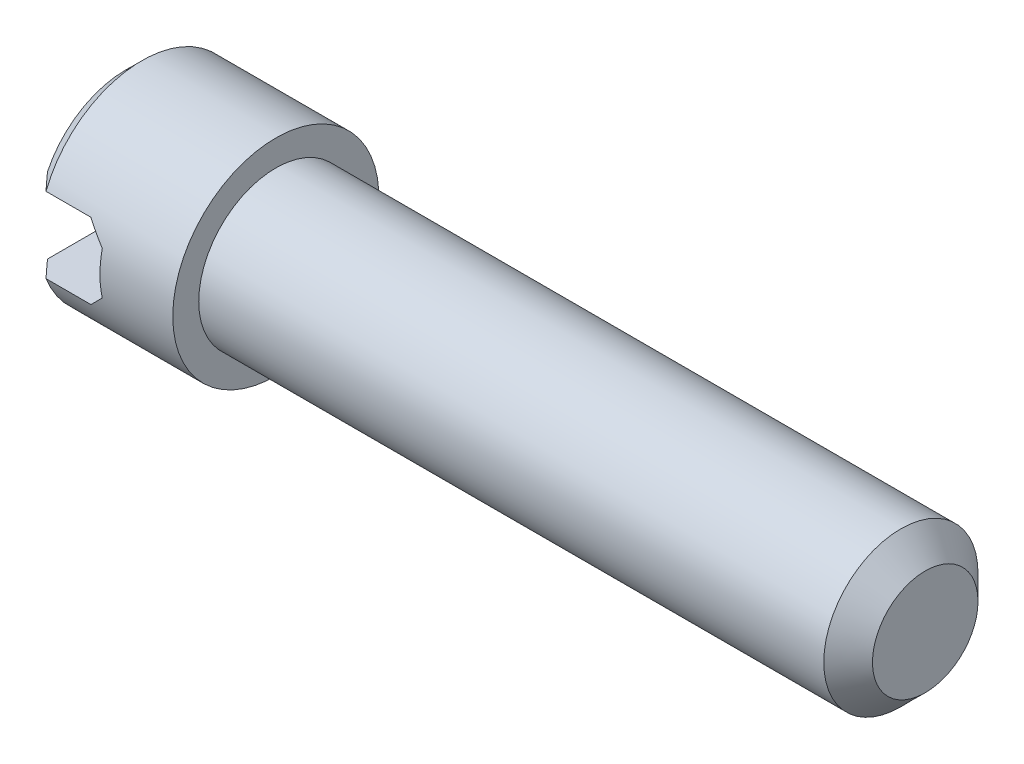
SolidWorks part; units mm, degrees
ref_plane "Face" through (0, 0, 0) normal (0, 0, 1) x (1, 0, 0)
ref_plane "Dessus" through (0, 0, 0) normal (0, 1, 0) x (1, 0, 0)
ref_plane "Droite" through (0, 0, 0) normal (1, 0, 0) x (0, 0, -1)
sketch "Esquisse1" plane through (0, 0, 0) normal (0, 0, 1) x (1, 0, 0)
  line L0 (0, 0) -> (0, 1.07)
  line L1 (0.2, 1.27) -> (1.85, 1.27)
  line L2 (1.85, 1.27) -> (1.85, 0)
  line L5 (0, 0) -> (7.6423, 0) construction
  line L7 (0, 1.07) -> (0.2, 1.27)
  line L8 (0, 0) -> (1.85, 0)
  point P1 (0, 1.27)
  dimension "D1" = 1.27
  dimension "D3" = 1.85
  dimension "D9" = 0.2
revolve "Révolution1" add sketch "Esquisse1" angle 360 about L5
sketch "Esquisse2" plane through (0, 0, 0) normal (0, 0, 1) x (1, 0, 0)
  line L0 (0, 1.07) -> (0, -1.07) construction
  line L1 (0, 0.4655) -> (0.7534, 0.4655)
  line L2 (0, 0.4655) -> (0, -0.4655)
  line L3 (0, -0.4655) -> (0.7534, -0.4655)
  line L4 (0.9534, 0.2655) -> (0.9534, -0.2655)
  line L5 (0.7534, 0.4655) -> (0.9534, 0.2655)
  line L6 (0.7534, -0.4655) -> (0.9534, -0.2655)
  point P1 (0.9534, -0.4655)
  point P3 (0.9534, 0.4655)
  dimension "D3" = 0.2
  dimension "D4" = 0.2
extrude "Enlèv. mat.-Extru.1" cut sketch "Esquisse2" against normal mid plane 10
sketch "Esquisse3" plane through (1.85, 0, 0) normal (1, 0, 0) x (0, 0, -1)
  circle A0 centre (0, 0) radius 0.95
extrude "Extrusion1" add sketch "Esquisse3" along normal blind 8
chamfer "Chanfrein1" distance 0.3 angle 45 1 edges at (9.85, 0, -0.95)
